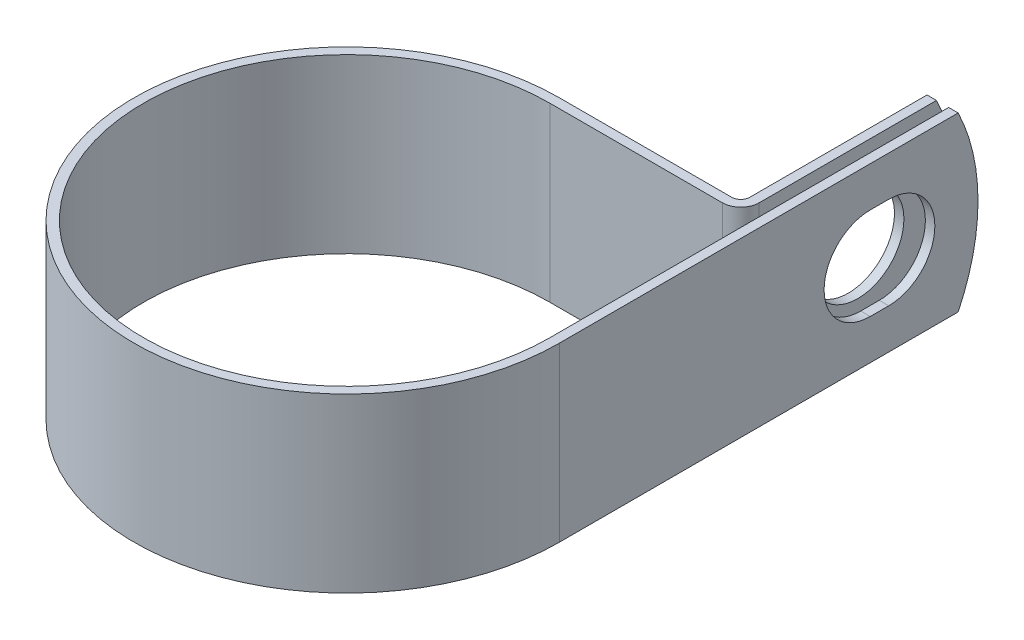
SolidWorks part; units mm, degrees
ref_plane "Front Plane" through (0, 0, 0) normal (0, 0, 1) x (1, 0, 0)
ref_plane "Top Plane" through (0, 0, 0) normal (0, 1, 0) x (1, 0, 0)
ref_plane "Right Plane" through (0, 0, 0) normal (1, 0, 0) x (0, 0, -1)
sketch "Sketch1" plane through (0, 0, 0) normal (0, 1, 0) x (1, 0, 0)
  line L0 (0, 26.1874) -> (22.2352, 26.1874)
  line L1 (26.1874, 0) -> (26.1874, 26.1874)
  line L2 (24.6126, 53.975) -> (24.6126, 28.5648)
  line L5 (26.1874, 26.1874) -> (26.1874, 53.975)
  arc A0 (0, 26.1874) -> (26.1874, 0) centre (0, 0) ccw
  arc A3 (22.2352, 26.1874) -> (24.6126, 28.5648) centre (22.2352, 28.5648) ccw
extrude "Extrude-Thin1" add sketch "Sketch1" along normal mid plane 22.225 thin
sketch "Sketch2" plane through (23.3934, 0, 0) normal (-1, 0, 0) x (0, 0, 1)
  line L0 (-53.975, 11.1125) -> (-53.975, -11.1125) construction
  line L7 (0, 11.1125) -> (0, -11.1125) construction
  circle A0 centre (-41.275, 0) radius 5.9436
  point P2 (-53.975, 0)
extrude "Cut-Extrude1" cut sketch "Sketch2" against normal up to surface (1.2192 mm away)
sketch "Sketch3" plane through (27.4066, 0, 0) normal (1, 0, 0) x (0, 0, -1)
  line L0 (40.0812, 0) -> (42.4688, 0) construction
  line L1 (40.0812, 5.9436) -> (42.4688, 5.9436)
  line L2 (40.0812, -5.9436) -> (42.4688, -5.9436)
  line L3 (53.975, 11.1125) -> (53.975, -11.1125) construction
  arc A0 (40.0812, 5.9436) -> (40.0812, -5.9436) centre (40.0812, 0) ccw
  arc A1 (42.4688, -5.9436) -> (42.4688, 5.9436) centre (42.4688, 0) ccw
  point P3 (41.275, 0)
  point P8 (53.975, 0)
  point P11 (34.1376, 0)
  point P12 (48.4124, 0)
extrude "Cut-Extrude2" cut sketch "Sketch3" against normal up to surface (1.2192 mm away)
sketch "Sketch4" plane through (23.3934, 0, 0) normal (-1, 0, 0) x (0, 0, 1)
  line L0 (-53.975, 11.1125) -> (-53.975, -11.1125)
  line L1 (-53.975, 11.1125) -> (-51.4151, 11.1125)
  line L2 (-53.975, 11.1125) -> (-28.5648, 11.1125) construction
  line L3 (-53.975, -11.1125) -> (-51.4151, -11.1125)
  line L4 (-53.975, -11.1125) -> (-28.5648, -11.1125) construction
  arc A0 (-51.4151, 11.1125) -> (-51.4151, -11.1125) centre (-28.575, 0) ccw
extrude "Cut-Extrude3" cut sketch "Sketch4" against normal through all contours A0 M4 M5 | A0 L0 M2
equation "\"D1@Sketch3\" = \"D2@Sketch2\""
equation "\"D7@Sketch1\" = \"D3@Sketch2\" + \"D1@Sketch3\""
equation "\"D1@Sketch4\" = ( \"D1@Extrude-Thin1\" + .125 ) * 2"
equation "\"D2@Sketch1\"=1.95*\"D5@Extrude-Thin1\""
equation "\"D2@Sketch3\" = \"D1@Sketch2\""
